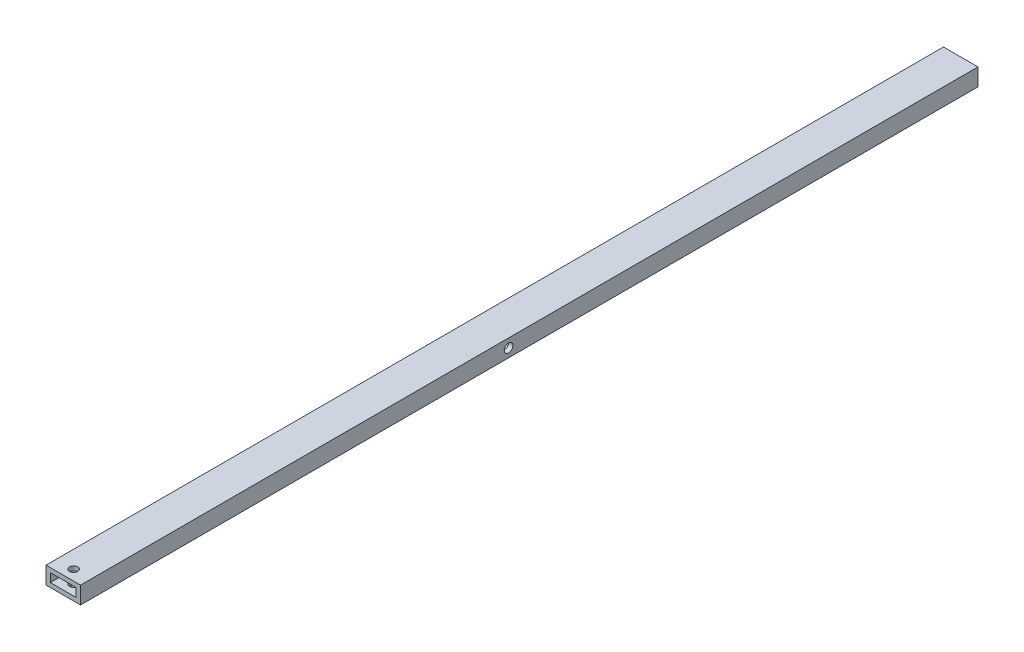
SolidWorks part; units mm, degrees
ref_plane "Front Plane" through (0, 0, 0) normal (0, 0, 1) x (1, 0, 0)
ref_plane "Top Plane" through (0, 0, 0) normal (0, 1, 0) x (1, 0, 0)
ref_plane "Right Plane" through (0, 0, 0) normal (1, 0, 0) x (0, 0, -1)
sketch "Sketch1" plane through (0, 0, 0) normal (0, 0, 1) x (1, 0, 0)
  line L0 (-4.7625, 1.5875) -> (4.7625, 1.5875)
  line L2 (-6.35, 3.175) -> (6.35, 3.175)
  line L3 (-6.35, 3.175) -> (-6.35, -3.175)
  line L4 (-6.35, -3.175) -> (6.35, -3.175)
  line L5 (6.35, 3.175) -> (6.35, -3.175)
  line L10 (4.7625, 1.5875) -> (4.7625, -1.5875)
  line L11 (-4.7625, -1.5875) -> (4.7625, -1.5875)
  line L12 (-4.7625, 1.5875) -> (-4.7625, -1.5875)
  point P12 (0, 3.175)
  point P14 (6.35, 0)
sketch "Sketch2" plane through (0, 0, 0) normal (1, 0, 0) x (0, 0, -1)
  line L0 (304.8, 0) -> (-304.8, 0)
  point P4 (0, 0)
  point P7 (-304.8, 0)
  point P10 (304.8, 0)
  dimension "Length" = 609.6
sketch "Sketch3" plane through (0, 0, 0) normal (0, 0, 1) x (1, 0, 0)
  line L21 (6.35, 3.175) -> (-6.35, 3.175)
  line L22 (6.35, -3.175) -> (6.35, 3.175)
  line L23 (-6.35, -3.175) -> (6.35, -3.175)
  line L24 (-6.35, 3.175) -> (-6.35, -3.175)
  line L25 (6.35, 3.175) -> (-6.35, 3.175)
  line L26 (6.35, -3.175) -> (6.35, 3.175)
  line L27 (-6.35, -3.175) -> (6.35, -3.175)
  line L28 (-6.35, 3.175) -> (-6.35, -3.175)
  line L29 (4.7625, 1.5875) -> (-4.7625, 1.5875)
  line L30 (4.7625, -1.5875) -> (4.7625, 1.5875)
  line L31 (-4.7625, -1.5875) -> (4.7625, -1.5875)
  line L32 (-4.7625, 1.5875) -> (-4.7625, -1.5875)
  line L33 (4.7625, 1.5875) -> (-4.7625, 1.5875)
  line L34 (4.7625, -1.5875) -> (4.7625, 1.5875)
  line L35 (-4.7625, -1.5875) -> (4.7625, -1.5875)
  line L36 (-4.7625, 1.5875) -> (-4.7625, -1.5875)
  dimension "D1" = 0
  dimension "D2" = 0
extrude "Boss-Extrude1" add sketch "Sketch3" along normal up to vertex (304.8 mm away) and the other way up to vertex (304.8 mm away)
sketch "Drawing Reference" plane through (0, 0, 0) normal (1, 0, 0) x (0, 0, -1)
  line L0 (-304.8, 0) -> (304.8, 0) construction
  line L1 (0, -3.175) -> (0, 3.175) construction
  line L2 (-304.8, -3.175) -> (304.8, -3.175) construction
  line L5 (-304.8, 3.175) -> (304.8, 3.175) construction
  point P7 (-295.656, 0)
  point P8 (295.656, 0)
sketch "Sketch4" plane through (0, 3.175, 0) normal (0, 1, 0) x (1, 0, 0)
  line L0 (6.35, -304.8) -> (-6.35, -304.8) construction
  circle A0 centre (0, -300.99) radius 1.5
  point P5 (0, -304.8)
  dimension "D1" = 3
  dimension "D3" = 3.81
extrude "Cut-Extrude1" cut sketch "Sketch4" against normal through all
sketch "Sketch6" plane through (6.35, 0, 0) normal (1, 0, 0) x (0, 0, -1)
  line L0 (-304.8, 3.175) -> (-304.8, -3.175) construction
  line L1 (-304.8, 3.175) -> (304.8, 3.175) construction
  circle A0 centre (-147.32, 0) radius 1.5875
  dimension "D1" = 3.175
  dimension "D2" = 157.48
  dimension "D3" = 3.175
extrude "Cut-Extrude2" cut sketch "Sketch6" against normal through all
sketch "Sketch7" plane through (0, 0, -304.8) normal (0, 0, -1) x (-1, 0, 0)
  line L1 (6.35, -3.175) -> (-6.35, -3.175)
  line L2 (6.35, -3.175) -> (6.35, 3.175)
  line L3 (6.35, 3.175) -> (-6.35, 3.175)
  line L4 (-6.35, -3.175) -> (-6.35, 3.175)
  line L5 (6.35, -3.175) -> (-6.35, 3.175) construction
  line L6 (6.35, 3.175) -> (-6.35, -3.175) construction
  point P0 (0, 0)
extrude "Cut-Extrude3" cut sketch "Sketch7" against normal blind 279.4
equation "\"D1@Drawing Reference\"=\"Outside Width@Sketch1\" * 0.72"
